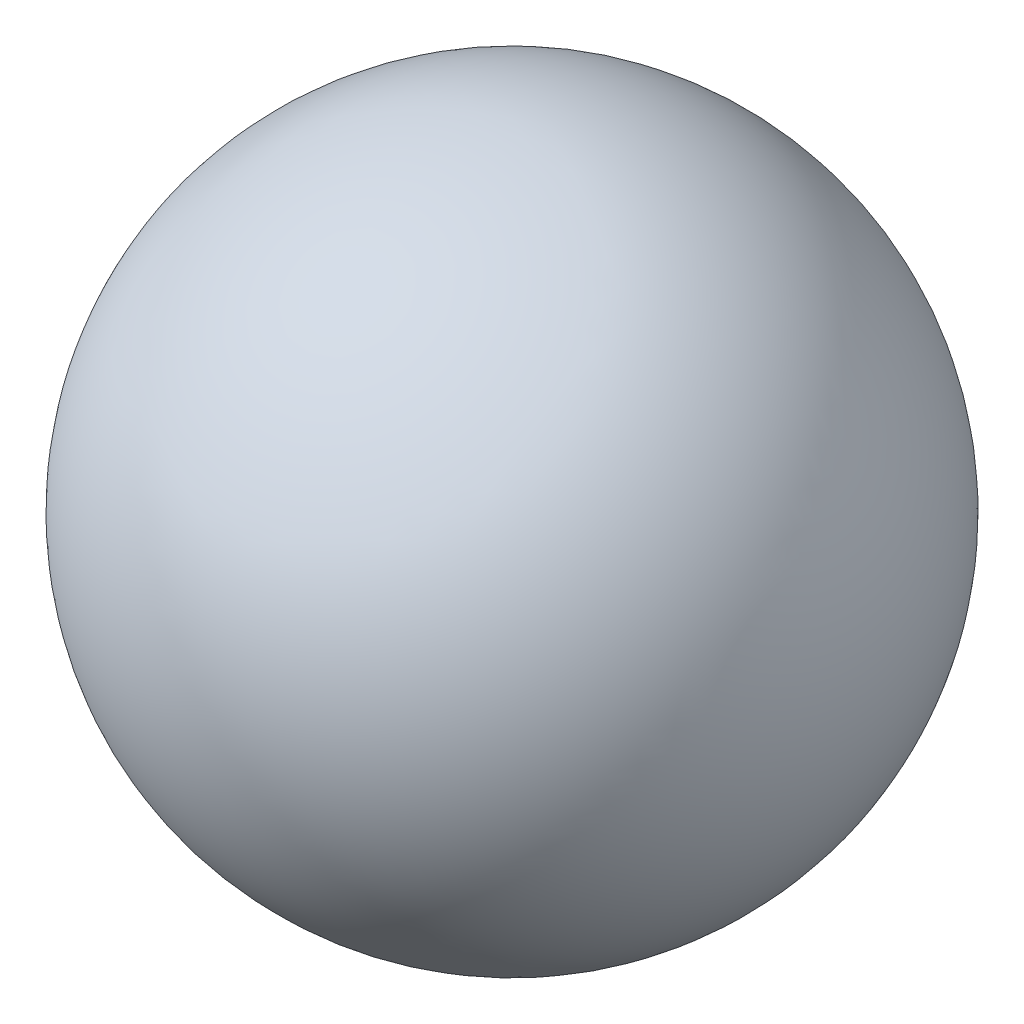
SolidWorks part; units mm, degrees
ref_plane "Plan1" through (0, 0, 0) normal (0, 0, 1) x (1, 0, 0)
ref_plane "Plan2" through (0, 0, 0) normal (0, 1, 0) x (1, 0, 0)
ref_plane "Plan3" through (0, 0, 0) normal (1, 0, 0) x (0, 0, -1)
sketch "Esquisse1" plane through (0, 0, 0) normal (0, 1, 0) x (1, 0, 0)
  line L1 (-2, 15.5) -> (28, 15.5) construction
  line L2 (-2, 31) -> (-2, 0) construction
  line L3 (28, 31) -> (28, 0) construction
  line L4 (2.5, 15.5) -> (23.5, 15.5)
  circle A1 centre (13, 15.5) radius 10.5 construction
  arc A2 (23.5, 15.5) -> (2.5, 15.5) centre (13, 15.5) ccw
revolve "Base-Révolution" add sketch "Esquisse1" angle 360 about L1
